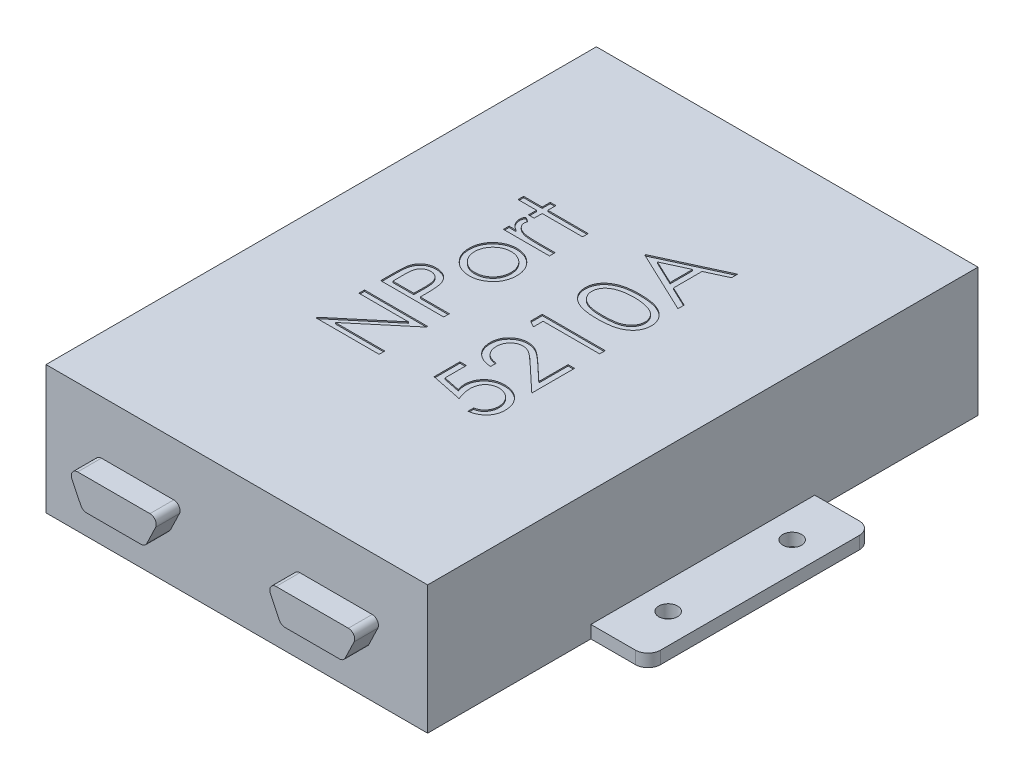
SolidWorks part; units mm, degrees
ref_plane "Front Plane" through (0, 0, 0) normal (0, 0, 1) x (1, 0, 0)
ref_plane "Top Plane" through (0, 0, 0) normal (0, 1, 0) x (1, 0, 0)
ref_plane "Right Plane" through (0, 0, 0) normal (1, 0, 0) x (0, 0, -1)
sketch "Sketch1" plane through (0, 0, 0) normal (0, 1, 0) x (1, 0, 0)
  line L1 (0, 110.998) -> (76.962, 110.998)
  line L2 (0, 110.998) -> (0, 0)
  line L3 (0, 0) -> (76.962, 0)
  line L4 (76.962, 110.998) -> (76.962, 0)
  point P4 (0, 0)
  dimension "D1" = 76.962
  dimension "D3" = 110.998
extrude "Boss-Extrude1" add sketch "Sketch1" along normal blind 25.908
sketch "Sketch2" plane through (102.87, 25.908, 0) normal (0, 1, 0) x (0, 0, -1)
  text T0 "NPort   5210A" font "Century Gothic" height 12.7
  point P1 (14.4389, 58.9415)
sketch "Sketch3" plane through (0, 0, 0) normal (0, 1, 0) x (1, 0, 0)
  line L0 (0, 110.998) -> (0, 0) construction
  line L1 (0, 78.0714) -> (-8.979, 78.0714)
  line L2 (0, 78.0714) -> (0, 32.9246)
  line L3 (0, 32.9246) -> (-8.979, 32.9246)
  line L4 (-11.519, 75.5314) -> (-11.519, 35.4646)
  line L5 (76.962, 110.998) -> (76.962, 0) construction
  line L6 (76.962, 78.0714) -> (85.941, 78.0714)
  line L7 (76.962, 78.0714) -> (76.962, 32.9246)
  line L8 (76.962, 32.9246) -> (85.941, 32.9246)
  line L9 (88.481, 75.5314) -> (88.481, 35.4646)
  line L10 (-5.519, 67.998) -> (-5.519, 42.998) construction
  line L11 (82.481, 67.998) -> (82.481, 42.998) construction
  line L12 (-5.519, 55.498) -> (82.481, 55.498) construction
  line L13 (0, 110.998) -> (76.962, 110.998) construction
  arc A0 (85.941, 78.0714) -> (88.481, 75.5314) centre (85.941, 75.5314) cw
  arc A1 (85.941, 32.9246) -> (88.481, 35.4646) centre (85.941, 35.4646) ccw
  arc A2 (-8.979, 32.9246) -> (-11.519, 35.4646) centre (-8.979, 35.4646) cw
  arc A3 (-8.979, 78.0714) -> (-11.519, 75.5314) centre (-8.979, 75.5314) ccw
  circle A4 centre (-5.519, 67.998) radius 1.8933
  circle A5 centre (-5.519, 42.998) radius 1.8933
  circle A6 centre (82.481, 67.998) radius 1.8933
  circle A7 centre (82.481, 42.998) radius 1.8933
  point P28 (38.481, 55.498)
  point P33 (38.481, 110.998)
  point P34 (0, 89.0643)
  point P35 (-11.519, 55.498)
  point P36 (85.941, 78.0714)
  dimension "D1" = 2.54
  dimension "D3" = 3.7867
  dimension "D2" = 25
  dimension "D4" = 43
  dimension "D5" = 88
  dimension "D6" = 100
extrude "Boss-Extrude2" add sketch "Sketch3" along normal blind 2.54
sketch "Sketch4" plane through (0, 0, 0) normal (0, 0, 1) x (1, 0, 0)
  line L0 (27.7824, 15.1507) -> (49.1796, 15.1507) construction
  line L1 (11.1789, 15.1507) -> (25.7622, 15.1507)
  line L2 (10.0345, 13.3302) -> (11.8242, 9.6095)
  line L3 (12.9686, 8.89) -> (23.9725, 8.89)
  line L4 (26.9067, 13.3302) -> (25.117, 9.6095)
  line L5 (51.1998, 15.1507) -> (65.7831, 15.1507)
  line L6 (50.0553, 13.3302) -> (51.845, 9.6095)
  line L7 (52.9895, 8.89) -> (63.9934, 8.89)
  line L8 (66.9275, 13.3302) -> (65.1378, 9.6095)
  line L9 (0, 0) -> (76.962, 0) construction
  arc A0 (65.7831, 15.1507) -> (66.9275, 13.3302) centre (65.7831, 13.8807) cw
  arc A1 (63.9934, 8.89) -> (65.1378, 9.6095) centre (63.9934, 10.16) ccw
  arc A2 (51.845, 9.6095) -> (52.9895, 8.89) centre (52.9895, 10.16) ccw
  arc A3 (51.1998, 15.1507) -> (50.0553, 13.3302) centre (51.1998, 13.8807) ccw
  arc A4 (25.7622, 15.1507) -> (26.9067, 13.3302) centre (25.7622, 13.8807) cw
  arc A5 (23.9725, 8.89) -> (25.117, 9.6095) centre (23.9725, 10.16) ccw
  arc A6 (11.8242, 9.6095) -> (12.9686, 8.89) centre (12.9686, 10.16) ccw
  arc A7 (11.1789, 15.1507) -> (10.0345, 13.3302) centre (11.1789, 13.8807) ccw
  point P8 (38.481, 15.1507)
  point P11 (38.481, 0)
  point P12 (12.091, 9.0623)
  point P13 (25.1671, 9.0623)
  point P14 (62.7313, 8.666)
  point P15 (51.3194, 8.5868)
  point P16 (18.4706, 8.89)
  point P17 (18.4706, 15.1507)
  point P18 (58.4914, 15.1507)
  point P19 (58.4914, 8.89)
  point P20 (52.1911, 8.349)
  point P39 (9.1588, 15.1507)
  dimension "D4" = 1.27
  dimension "D1" = 18.6236
  dimension "D2" = 6.2607
  dimension "D3" = 8.89
extrude "Boss-Extrude3" add sketch "Sketch4" along normal blind 4.8
sketch "Sketch5" plane through (0, 0, -110.998) normal (0, 0, -1) x (-1, 0, 0)
  circle A0 centre (-11.2985, 11.6775) radius 3.5864
extrude "Boss-Extrude4" add sketch "Sketch5" along normal blind 4.8
sketch "Sketch6" plane through (0, 0, -110.998) normal (0, 0, -1) x (-1, 0, 0)
  line L0 (-50.3196, 10.2207) -> (-47.5146, 10.2207)
  line L1 (-59.1946, 16.0852) -> (-47.5146, 16.0852)
  line L2 (-59.1946, 16.0852) -> (-59.1946, 10.2207)
  line L3 (-59.1946, 10.2207) -> (-56.3896, 10.2207)
  line L4 (-47.5146, 16.0852) -> (-47.5146, 10.2207)
  line L6 (-56.3896, 10.2207) -> (-56.3896, 8.715)
  line L7 (-56.3896, 8.715) -> (-54.9796, 8.715)
  line L8 (-50.3196, 10.2207) -> (-50.3196, 8.715)
  line L10 (-54.9796, 8.715) -> (-54.9796, 7.6055)
  line L11 (-54.9796, 7.6055) -> (-51.7296, 7.6055)
  line L12 (-51.7296, 8.715) -> (-51.7296, 7.6055)
  line L13 (-51.7296, 8.715) -> (-50.3196, 8.715)
  line L15 (-37.311, 14.5254) -> (-25.4827, 14.5254)
  line L16 (-37.311, 14.5254) -> (-37.311, 11.4059)
  line L17 (-37.311, 11.4059) -> (-25.4827, 11.4059)
  line L18 (-25.4827, 14.5254) -> (-25.4827, 11.4059)
  dimension "D1" = 11.68
  dimension "D2" = 6.07
  dimension "D3" = 3.25
extrude "Cut-Extrude1" cut sketch "Sketch6" against normal blind 4.8
extrude "Cut-Extrude2" cut sketch "Sketch2" against normal blind 0.254
equation "\"Buoyancy\"=\"SW-Volume\"*(\"SW-Density\"-.037062)"
